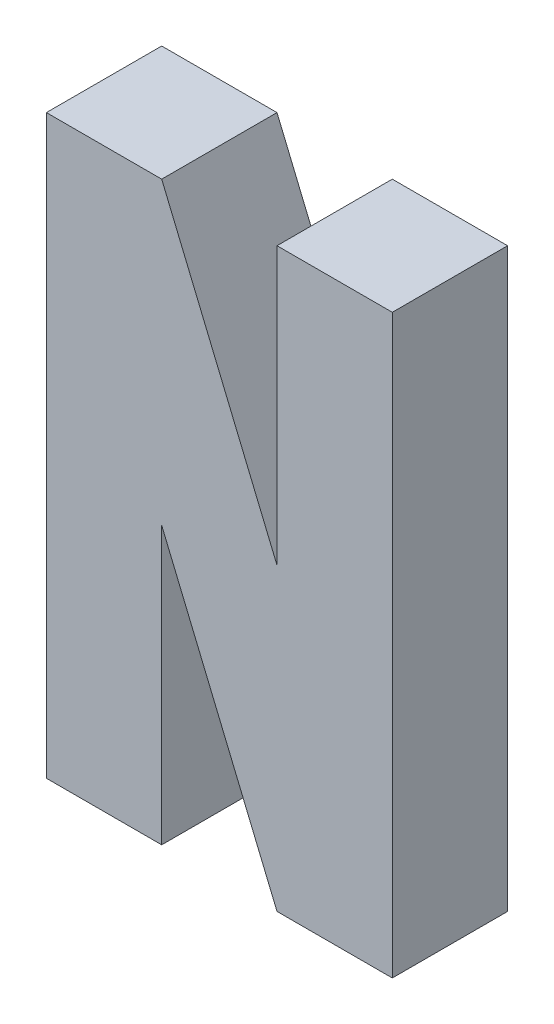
SolidWorks part; units mm, degrees
ref_plane "Plan de face" through (0, 0, 0) normal (0, 0, 1) x (1, 0, 0)
ref_plane "Plan de dessus" through (0, 0, 0) normal (0, 1, 0) x (1, 0, 0)
ref_plane "Plan de droite" through (0, 0, 0) normal (1, 0, 0) x (0, 0, -1)
sketch "Esquisse1" plane through (0, 0, 0) normal (0, 0, 1) x (1, 0, 0)
  line L0 (10, 50) -> (20, 26)
  line L1 (0, 0) -> (10, 0)
  line L2 (0, 0) -> (0, 50)
  line L3 (0, 50) -> (10, 50)
  line L4 (10, 0) -> (10, 24)
  line L5 (20, 50) -> (30, 50)
  line L6 (20, 50) -> (20, 26)
  line L7 (20, 0) -> (30, 0)
  line L8 (30, 50) -> (30, 0)
  line L9 (20, 0) -> (10, 24)
  dimension "D1" = 10
  dimension "D2" = 10
  dimension "D3" = 50
  dimension "D4" = 50
  dimension "D5" = 10
  dimension "D6" = 30
extrude "Boss.-Extru.1" add sketch "Esquisse1" along normal blind 10
